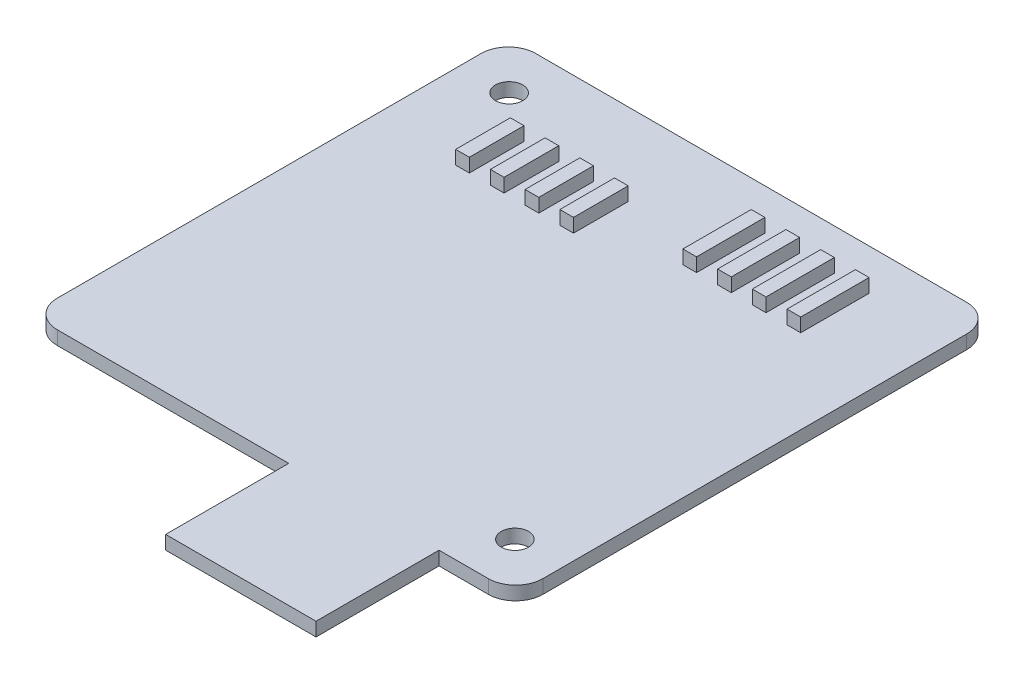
SolidWorks part; units mm, degrees
ref_plane "Front Plane" through (0, 0, 0) normal (0, 0, 1) x (1, 0, 0)
ref_plane "Top Plane" through (0, 0, 0) normal (0, 1, 0) x (1, 0, 0)
ref_plane "Right Plane" through (0, 0, 0) normal (1, 0, 0) x (0, 0, -1)
sketch "Sketch1" plane through (0, 0, 0) normal (0, 1, 0) x (1, 0, 0)
  line L0 (-18.7639, -15.5) -> (-18.7639, 15.5) construction
  line L1 (-15.7639, -17.5) -> (1.1648, -17.5)
  line L2 (-17.7639, -15.5) -> (-17.7639, 15.5)
  line L3 (-15.7639, 17.5) -> (15.7639, 17.5)
  line L4 (17.7639, -15.5) -> (17.7639, 15.5)
  line L5 (-17.7639, -17.5) -> (17.7639, 17.5) construction
  line L6 (-17.7639, 17.5) -> (17.7639, -17.5) construction
  line L7 (0, 0) -> (0, 3.7142) construction
  line L8 (1.1648, -17.5) -> (12.1648, -17.5) construction
  line L9 (1.1648, -17.5) -> (12.1648, -17.5) construction
  line L10 (1.1648, -17.5) -> (1.1648, -26.5)
  line L11 (1.1648, -26.5) -> (12.1648, -26.5)
  line L12 (12.1648, -17.5) -> (12.1648, -26.5)
  line L13 (12.1648, -17.5) -> (15.7639, -17.5)
  line L14 (18.7639, -15.5) -> (18.7639, 15.5) construction
  line L15 (14.2476, -14.0359) -> (-14.2476, 14.0359) construction
  arc A0 (-15.7639, -17.5) -> (-17.7639, -15.5) centre (-15.7639, -15.5) cw
  arc A1 (15.7639, -17.5) -> (17.7639, -15.5) centre (15.7639, -15.5) ccw
  arc A2 (15.7639, 17.5) -> (17.7639, 15.5) centre (15.7639, 15.5) cw
  arc A3 (-17.7639, 15.5) -> (-15.7639, 17.5) centre (-15.7639, 15.5) cw
  circle A4 centre (-14.2476, 14.0359) radius 1
  circle A6 centre (14.2476, -14.0359) radius 1
  point P0 (0, 0)
  point P35 (0, 0)
  dimension "D2" = 2
  dimension "D3" = 2
  dimension "D1" = 35.5278
  dimension "D4" = 35
  dimension "D5" = 1
  dimension "D6" = 11
  dimension "D7" = 9
  dimension "D8" = 40
  dimension "D9" = 1
extrude "Boss-Extrude1" add sketch "Sketch1" along normal blind 1
sketch "Sketch2" plane through (0, 1, 0) normal (0, 1, 0) x (1, 0, 0)
  line L0 (0, 0) -> (0, 17.5) construction
  line L1 (15.7639, 17.5) -> (-15.7639, 17.5) construction
  line L3 (-17.7639, 15.5) -> (-17.7639, -15.5) construction
  line L4 (15.7639, 14.5) -> (-15.7639, 14.5)
  line L5 (17.7639, 14.5) -> (-17.7639, 14.5) construction
  line L6 (17.7639, -15.5) -> (17.7639, 15.5) construction
  line L8 (5.54, 14.5) -> (6.54, 14.5)
  line L9 (15.7639, 11.5) -> (-15.7639, 11.5)
  line L10 (15.7639, 11.5) -> (-15.7639, 11.5) construction
  line L11 (3, 14.5) -> (4, 14.5)
  line L12 (3, 14.5) -> (3, 9.5)
  line L13 (3, 9.5) -> (4, 9.5)
  line L14 (4, 14.5) -> (4, 9.5)
  line L15 (6.54, 14.5) -> (6.54, 9.5)
  line L16 (5.54, 9.5) -> (6.54, 9.5)
  line L17 (5.54, 14.5) -> (5.54, 9.5)
  line L18 (8.08, 14.5) -> (9.08, 14.5)
  line L19 (9.08, 14.5) -> (9.08, 9.5)
  line L20 (8.08, 9.5) -> (9.08, 9.5)
  line L21 (8.08, 14.5) -> (8.08, 9.5)
  line L22 (10.62, 14.5) -> (11.62, 14.5)
  line L23 (11.62, 14.5) -> (11.62, 9.5)
  line L24 (10.62, 9.5) -> (11.62, 9.5)
  line L25 (10.62, 14.5) -> (10.62, 9.5)
  line L26 (-5.54, 11.5) -> (-6.54, 11.5)
  line L27 (-3, 11.5) -> (-4, 11.5)
  line L28 (-3, 11.5) -> (-3, 7.5)
  line L29 (-3, 7.5) -> (-4, 7.5)
  line L30 (-4, 11.5) -> (-4, 7.5)
  line L31 (-6.54, 11.5) -> (-6.54, 7.5)
  line L32 (-5.54, 7.5) -> (-6.54, 7.5)
  line L33 (-5.54, 11.5) -> (-5.54, 7.5)
  line L34 (-8.08, 11.5) -> (-9.08, 11.5)
  line L35 (-9.08, 11.5) -> (-9.08, 7.5)
  line L36 (-8.08, 7.5) -> (-9.08, 7.5)
  line L37 (-8.08, 11.5) -> (-8.08, 7.5)
  line L38 (-10.62, 11.5) -> (-11.62, 11.5)
  line L39 (-11.62, 11.5) -> (-11.62, 7.5)
  line L40 (-10.62, 7.5) -> (-11.62, 7.5)
  line L41 (-10.62, 11.5) -> (-10.62, 7.5)
  dimension "D3" = 1
  dimension "D4" = 5
  dimension "D5" = 3
  dimension "D7" = 4
  dimension "D8" = 3
  dimension "D1" = 3
  dimension "D2" = 6
  dimension "D6" = 4
  dimension "D9" = 4
extrude "Boss-Extrude2" add sketch "Sketch2" along normal blind 1
equation "\"thkness\"= 2mm"
equation "\"size\"= 65mm"
equation "\"side_len\"= \"size\" / (2 * sin ( 60 ) )"
equation "\"height\"= 50mm"
